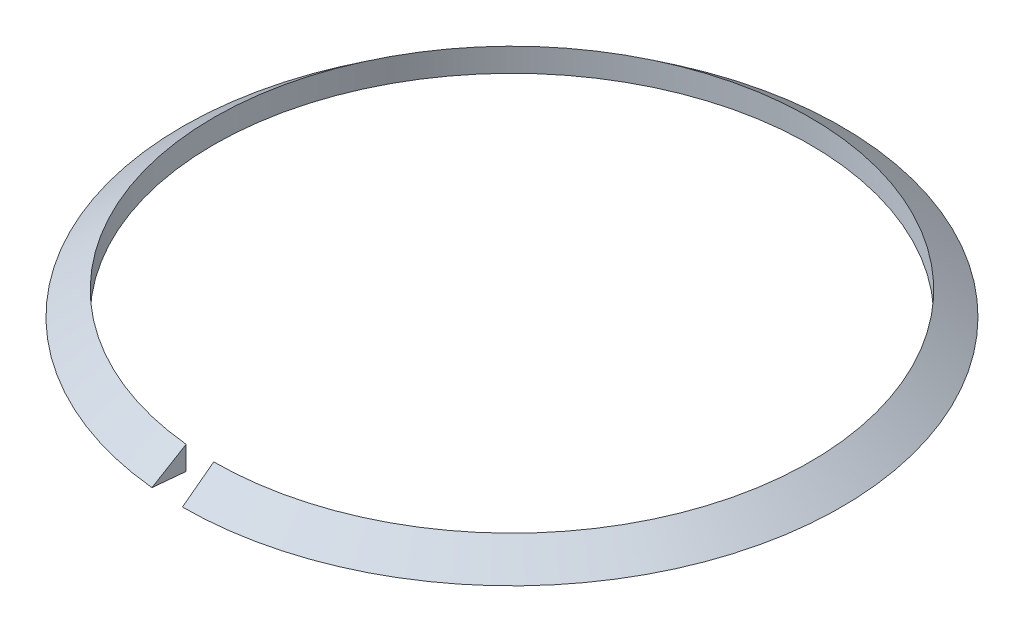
SolidWorks part; units mm, degrees
ref_plane "Front Plane" through (0, 0, 0) normal (0, 0, 1) x (1, 0, 0)
ref_plane "Top Plane" through (0, 0, 0) normal (0, 1, 0) x (1, 0, 0)
ref_plane "Right Plane" through (0, 0, 0) normal (1, 0, 0) x (0, 0, -1)
sketch "Sketch1" plane through (0, 0, 0) normal (1, 0, 0) x (0, 0, -1)
  line L0 (0, 0) -> (0, 10.6046) construction
  line L1 (0, 0) -> (-19.05, 0) construction
  line L2 (-19.05, 0.7506) -> (-19.05, -0.7506)
  line L3 (-19.05, -0.7506) -> (-21.049, -0.7506)
  line L4 (-21.049, -0.7506) -> (-19.05, 0.7506)
  dimension "D1" = 1.5011
  dimension "D2" = 1.999
  dimension "D3" = 38.1
revolve "Revolve1" add sketch "Sketch1" angle 354.415 about L0
